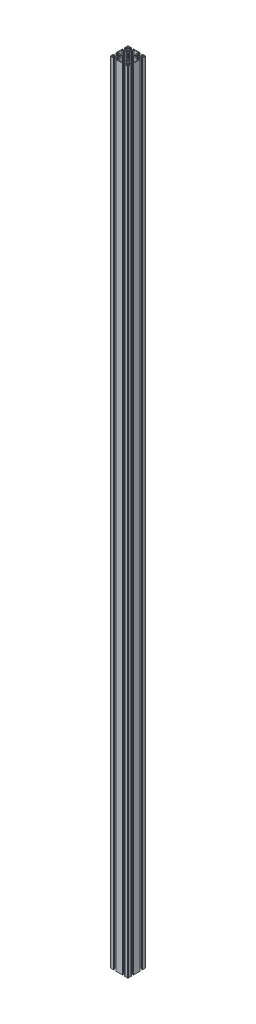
SolidWorks part; units mm, degrees
ref_plane "Front Plane" through (0, 0, 0) normal (0, 0, 1) x (1, 0, 0)
ref_plane "Top Plane" through (0, 0, 0) normal (0, 1, 0) x (1, 0, 0)
ref_plane "Right Plane" through (0, 0, 0) normal (1, 0, 0) x (0, 0, -1)
sketch "Sketch1" plane through (0, 0, 0) normal (0, 1, 0) x (1, 0, 0)
  line L0 (505.2058, 27.1189) -> (507.2058, 27.1189)
  line L1 (507.2058, 25.1189) -> (496.7058, 25.1189)
  line L2 (495.7058, 26.1189) -> (495.7058, 36.6189)
  line L3 (497.7058, 36.6189) -> (497.7058, 34.6189)
  line L4 (498.7058, 33.6189) -> (503.8258, 33.6189)
  line L5 (504.2058, 33.2389) -> (504.2058, 28.1189)
  line L6 (522.0488, 41.8952) -> (520.4218, 42.9309)
  line L7 (518.8935, 41.4027) -> (519.9294, 39.776)
  line L8 (517.7043, 38.8542) -> (517.2863, 40.7371)
  line L9 (515.125, 40.7371) -> (514.7072, 38.8544)
  line L10 (512.482, 39.776) -> (513.5178, 41.4029)
  line L11 (511.9896, 42.9313) -> (510.3629, 41.8954)
  line L12 (509.4411, 44.1204) -> (511.324, 44.5385)
  line L13 (511.324, 46.6998) -> (509.4413, 47.1175)
  line L14 (510.3628, 49.3427) -> (511.9898, 48.3069)
  line L15 (513.5181, 49.8351) -> (512.4822, 51.4618)
  line L16 (514.7073, 52.3836) -> (515.1254, 50.5008)
  line L17 (517.2867, 50.5007) -> (517.7044, 52.3835)
  line L18 (519.9296, 51.4619) -> (518.8938, 49.8349)
  line L19 (520.422, 48.3066) -> (522.0487, 49.3425)
  line L20 (522.9705, 47.1174) -> (521.0877, 46.6994)
  line L21 (521.0876, 44.5381) -> (522.9703, 44.1203)
  line L22 (579.7058, 34.6189) -> (579.7058, 36.6189)
  line L23 (581.7058, 36.6189) -> (581.7058, 26.1189)
  line L24 (580.7058, 25.1189) -> (570.2058, 25.1189)
  line L25 (570.2058, 27.1189) -> (572.2058, 27.1189)
  line L26 (573.2058, 28.1189) -> (573.2058, 33.2389)
  line L27 (573.5858, 33.6189) -> (578.7058, 33.6189)
  line L28 (565.422, 48.3066) -> (567.0487, 49.3425)
  line L29 (567.9705, 47.1174) -> (566.0877, 46.6994)
  line L30 (566.0876, 44.5381) -> (567.9703, 44.1203)
  line L31 (567.0488, 41.8952) -> (565.4218, 42.9309)
  line L32 (563.8935, 41.4027) -> (564.9294, 39.776)
  line L33 (562.7043, 38.8542) -> (562.2863, 40.7371)
  line L34 (560.125, 40.7371) -> (559.7072, 38.8544)
  line L35 (557.482, 39.776) -> (558.5178, 41.4029)
  line L36 (556.9896, 42.9313) -> (555.3629, 41.8954)
  line L37 (554.4411, 44.1204) -> (556.324, 44.5385)
  line L38 (556.324, 46.6998) -> (554.4413, 47.1175)
  line L39 (555.3628, 49.3427) -> (556.9898, 48.3069)
  line L40 (558.5181, 49.8351) -> (557.4822, 51.4618)
  line L41 (559.7073, 52.3836) -> (560.1254, 50.5008)
  line L42 (562.2867, 50.5007) -> (562.7044, 52.3835)
  line L43 (564.9296, 51.4619) -> (563.8938, 49.8349)
  line L44 (573.2058, 102.9989) -> (573.2058, 108.1189)
  line L45 (572.2058, 109.1189) -> (570.2058, 109.1189)
  line L46 (570.2058, 111.1189) -> (580.7058, 111.1189)
  line L47 (581.7058, 110.1189) -> (581.7058, 99.6189)
  line L48 (579.7058, 99.6189) -> (579.7058, 101.6189)
  line L49 (578.7058, 102.6189) -> (573.5858, 102.6189)
  line L50 (565.422, 93.3066) -> (567.0487, 94.3425)
  line L51 (567.9705, 92.1174) -> (566.0877, 91.6994)
  line L52 (566.0876, 89.5381) -> (567.9703, 89.1203)
  line L53 (567.0488, 86.8952) -> (565.4218, 87.9309)
  line L54 (563.8935, 86.4027) -> (564.9294, 84.776)
  line L55 (562.7043, 83.8542) -> (562.2863, 85.7371)
  line L56 (560.125, 85.7371) -> (559.7072, 83.8544)
  line L57 (557.482, 84.776) -> (558.5178, 86.4029)
  line L58 (556.9896, 87.9313) -> (555.3629, 86.8954)
  line L59 (554.4411, 89.1204) -> (556.324, 89.5385)
  line L60 (556.324, 91.6998) -> (554.4413, 92.1175)
  line L61 (555.3628, 94.3427) -> (556.9898, 93.3069)
  line L62 (558.5181, 94.8351) -> (557.4822, 96.4618)
  line L63 (559.7073, 97.3836) -> (560.1254, 95.5008)
  line L64 (562.2867, 95.5007) -> (562.7044, 97.3835)
  line L65 (564.9296, 96.4619) -> (563.8938, 94.8349)
  line L66 (497.7058, 101.6189) -> (497.7058, 99.6189)
  line L67 (495.7058, 99.6189) -> (495.7058, 110.1189)
  line L68 (496.7058, 111.1189) -> (507.2058, 111.1189)
  line L69 (507.2058, 109.1189) -> (505.2058, 109.1189)
  line L70 (504.2058, 108.1189) -> (504.2058, 102.9989)
  line L71 (503.8258, 102.6189) -> (498.7058, 102.6189)
  line L72 (522.0488, 86.8952) -> (520.4218, 87.9309)
  line L73 (518.8935, 86.4027) -> (519.9294, 84.776)
  line L74 (517.7043, 83.8542) -> (517.2863, 85.7371)
  line L75 (515.125, 85.7371) -> (514.7072, 83.8544)
  line L76 (512.482, 84.776) -> (513.5178, 86.4029)
  line L77 (511.9896, 87.9313) -> (510.3629, 86.8954)
  line L78 (509.4411, 89.1204) -> (511.324, 89.5385)
  line L79 (511.324, 91.6998) -> (509.4413, 92.1175)
  line L80 (510.3628, 94.3427) -> (511.9898, 93.3069)
  line L81 (513.5181, 94.8351) -> (512.4822, 96.4618)
  line L82 (514.7073, 97.3836) -> (515.1254, 95.5008)
  line L83 (517.2867, 95.5007) -> (517.7044, 97.3835)
  line L84 (519.9296, 96.4619) -> (518.8938, 94.8349)
  line L85 (520.422, 93.3066) -> (522.0487, 94.3425)
  line L86 (522.9705, 92.1174) -> (521.0877, 91.6994)
  line L87 (521.0876, 89.5381) -> (522.9703, 89.1203)
  line L88 (577.7058, 57.9589) -> (572.0832, 57.9589)
  line L89 (570.669, 57.3731) -> (568.5261, 55.2302)
  line L90 (568.2574, 55.1189) -> (562.1058, 55.1189)
  line L91 (562.1058, 55.1189) -> (561.2058, 54.6038)
  line L92 (561.2058, 54.6038) -> (560.3058, 55.1189)
  line L93 (560.3058, 55.1189) -> (553.7058, 55.1189)
  line L94 (551.7058, 53.1189) -> (551.7058, 46.5189)
  line L95 (551.7058, 46.5189) -> (552.2254, 45.6189)
  line L96 (552.2254, 45.6189) -> (551.7058, 44.7189)
  line L97 (551.7058, 44.7189) -> (551.7058, 38.5674)
  line L98 (551.5945, 38.2987) -> (550.0845, 36.7886)
  line L99 (549.2058, 34.6673) -> (549.2058, 28.1189)
  line L100 (550.2058, 27.1189) -> (552.2058, 27.1189)
  line L101 (552.2058, 25.1189) -> (525.2058, 25.1189)
  line L102 (525.2058, 27.1189) -> (527.2058, 27.1189)
  line L103 (528.2058, 28.1189) -> (528.2058, 34.6673)
  line L104 (527.3271, 36.7886) -> (525.8171, 38.2987)
  line L105 (525.7058, 38.5674) -> (525.7058, 44.7189)
  line L106 (525.7058, 44.7189) -> (525.1862, 45.6189)
  line L107 (525.1862, 45.6189) -> (525.7058, 46.5189)
  line L108 (525.7058, 46.5189) -> (525.7058, 53.1189)
  line L109 (523.7058, 55.1189) -> (517.1058, 55.1189)
  line L110 (517.1058, 55.1189) -> (516.2058, 54.6038)
  line L111 (516.2058, 54.6038) -> (515.3058, 55.1189)
  line L112 (515.3058, 55.1189) -> (509.1542, 55.1189)
  line L113 (508.8855, 55.2302) -> (506.7426, 57.3731)
  line L114 (505.3284, 57.9589) -> (499.7058, 57.9589)
  line L115 (497.7058, 55.9589) -> (497.7058, 54.6189)
  line L116 (495.7058, 54.6189) -> (495.7058, 81.6189)
  line L117 (497.7058, 81.6189) -> (497.7058, 80.2789)
  line L118 (499.7058, 78.2789) -> (505.3284, 78.2789)
  line L119 (506.7426, 78.8647) -> (508.8855, 81.0076)
  line L120 (509.1542, 81.1189) -> (515.3058, 81.1189)
  line L121 (515.3058, 81.1189) -> (516.2058, 81.6341)
  line L122 (516.2058, 81.6341) -> (517.1058, 81.1189)
  line L123 (517.1058, 81.1189) -> (523.7058, 81.1189)
  line L124 (525.7058, 83.1189) -> (525.7058, 89.7189)
  line L125 (525.7058, 89.7189) -> (525.1862, 90.6189)
  line L126 (525.1862, 90.6189) -> (525.7058, 91.5189)
  line L127 (525.7058, 91.5189) -> (525.7058, 97.6705)
  line L128 (525.8171, 97.9392) -> (527.3271, 99.4492)
  line L129 (528.2058, 101.5705) -> (528.2058, 108.1189)
  line L130 (527.2058, 109.1189) -> (525.2058, 109.1189)
  line L131 (525.2058, 111.1189) -> (552.2058, 111.1189)
  line L132 (552.2058, 109.1189) -> (550.2058, 109.1189)
  line L133 (549.2058, 108.1189) -> (549.2058, 101.5705)
  line L134 (550.0845, 99.4492) -> (551.5945, 97.9392)
  line L135 (551.7058, 97.6705) -> (551.7058, 91.5189)
  line L136 (551.7058, 91.5189) -> (552.2254, 90.6189)
  line L137 (552.2254, 90.6189) -> (551.7058, 89.7189)
  line L138 (551.7058, 89.7189) -> (551.7058, 83.1189)
  line L139 (553.7058, 81.1189) -> (560.3058, 81.1189)
  line L140 (560.3058, 81.1189) -> (561.2058, 81.6341)
  line L141 (561.2058, 81.6341) -> (562.1058, 81.1189)
  line L142 (562.1058, 81.1189) -> (568.2574, 81.1189)
  line L143 (568.5261, 81.0076) -> (570.6639, 78.8698)
  line L144 (572.0781, 78.284) -> (577.7058, 78.284)
  line L145 (579.7058, 80.284) -> (579.7058, 81.6189)
  line L146 (581.7058, 81.6189) -> (581.7058, 54.6189)
  line L147 (579.7058, 54.6189) -> (579.7058, 55.9589)
  line L148 (583.7058, 52.2039) -> (583.7058, 84.0339)
  line L149 (582.1858, 85.5539) -> (579.2258, 85.5539)
  line L150 (577.7058, 84.0339) -> (577.7058, 81.5689)
  line L151 (576.7058, 80.5689) -> (573.7042, 80.5689)
  line L152 (573.4355, 80.6802) -> (570.8171, 83.2987)
  line L153 (570.7058, 83.5674) -> (570.7058, 89.7189)
  line L154 (570.7058, 89.7189) -> (570.1862, 90.6189)
  line L155 (570.1862, 90.6189) -> (570.7058, 91.5189)
  line L156 (570.7058, 91.5189) -> (570.7058, 97.6705)
  line L157 (570.8171, 97.9392) -> (573.4355, 100.5576)
  line L158 (573.7042, 100.6689) -> (576.7058, 100.6689)
  line L159 (577.7058, 99.6689) -> (577.7058, 97.2039)
  line L160 (579.2258, 95.6839) -> (582.1858, 95.6839)
  line L161 (583.7058, 97.2039) -> (583.7058, 110.1189)
  line L162 (580.7058, 113.1189) -> (567.7908, 113.1189)
  line L163 (566.2708, 111.5989) -> (566.2708, 108.6389)
  line L164 (567.7908, 107.1189) -> (570.2558, 107.1189)
  line L165 (571.2558, 106.1189) -> (571.2558, 103.1174)
  line L166 (571.1445, 102.8487) -> (568.5261, 100.2302)
  line L167 (568.2574, 100.1189) -> (562.1058, 100.1189)
  line L168 (562.1058, 100.1189) -> (561.2058, 99.6038)
  line L169 (561.2058, 99.6038) -> (560.3058, 100.1189)
  line L170 (560.3058, 100.1189) -> (554.1542, 100.1189)
  line L171 (553.8855, 100.2302) -> (551.2671, 102.8487)
  line L172 (551.1558, 103.1174) -> (551.1558, 106.1189)
  line L173 (552.1558, 107.1189) -> (554.6208, 107.1189)
  line L174 (556.1408, 108.6389) -> (556.1408, 111.5989)
  line L175 (554.6208, 113.1189) -> (522.7908, 113.1189)
  line L176 (521.2708, 111.5989) -> (521.2708, 108.6389)
  line L177 (522.7908, 107.1189) -> (525.2558, 107.1189)
  line L178 (526.2558, 106.1189) -> (526.2558, 103.1174)
  line L179 (526.1445, 102.8487) -> (523.5261, 100.2302)
  line L180 (523.2574, 100.1189) -> (517.1058, 100.1189)
  line L181 (517.1058, 100.1189) -> (516.2058, 99.6038)
  line L182 (516.2058, 99.6038) -> (515.3058, 100.1189)
  line L183 (515.3058, 100.1189) -> (509.1542, 100.1189)
  line L184 (508.8855, 100.2302) -> (506.2671, 102.8487)
  line L185 (506.1558, 103.1174) -> (506.1558, 106.1189)
  line L186 (507.1558, 107.1189) -> (509.6208, 107.1189)
  line L187 (511.1408, 108.6389) -> (511.1408, 111.5989)
  line L188 (509.6208, 113.1189) -> (496.7058, 113.1189)
  line L189 (493.7058, 110.1189) -> (493.7058, 97.2039)
  line L190 (495.2258, 95.6839) -> (498.1858, 95.6839)
  line L191 (499.7058, 97.2039) -> (499.7058, 99.6689)
  line L192 (500.7058, 100.6689) -> (503.7074, 100.6689)
  line L193 (503.9761, 100.5576) -> (506.5945, 97.9392)
  line L194 (506.7058, 97.6705) -> (506.7058, 91.5189)
  line L195 (506.7058, 91.5189) -> (507.2254, 90.6189)
  line L196 (507.2254, 90.6189) -> (506.7058, 89.7189)
  line L197 (506.7058, 89.7189) -> (506.7058, 83.5674)
  line L198 (506.5945, 83.2987) -> (503.9761, 80.6802)
  line L199 (503.7074, 80.5689) -> (500.7058, 80.5689)
  line L200 (499.7058, 81.5689) -> (499.7058, 84.0339)
  line L201 (498.1858, 85.5539) -> (495.2258, 85.5539)
  line L202 (493.7058, 84.0339) -> (493.7058, 52.2039)
  line L203 (495.2258, 50.6839) -> (498.1858, 50.6839)
  line L204 (499.7058, 52.2039) -> (499.7058, 54.6689)
  line L205 (500.7058, 55.6689) -> (503.7074, 55.6689)
  line L206 (503.9761, 55.5576) -> (506.5945, 52.9392)
  line L207 (506.7058, 52.6705) -> (506.7058, 46.5189)
  line L208 (506.7058, 46.5189) -> (507.2254, 45.6189)
  line L209 (507.2254, 45.6189) -> (506.7058, 44.7189)
  line L210 (506.7058, 44.7189) -> (506.7058, 38.5674)
  line L211 (506.5945, 38.2987) -> (503.9761, 35.6802)
  line L212 (503.7074, 35.5689) -> (500.7058, 35.5689)
  line L213 (499.7058, 36.5689) -> (499.7058, 39.0339)
  line L214 (498.1858, 40.5539) -> (495.2258, 40.5539)
  line L215 (493.7058, 39.0339) -> (493.7058, 26.1189)
  line L216 (496.7058, 23.1189) -> (509.6208, 23.1189)
  line L217 (511.1408, 24.6389) -> (511.1408, 27.5989)
  line L218 (509.6208, 29.1189) -> (507.1558, 29.1189)
  line L219 (506.1558, 30.1189) -> (506.1558, 33.1205)
  line L220 (506.2671, 33.3892) -> (508.8855, 36.0076)
  line L221 (509.1542, 36.1189) -> (515.3058, 36.1189)
  line L222 (515.3058, 36.1189) -> (516.2058, 36.6341)
  line L223 (516.2058, 36.6341) -> (517.1058, 36.1189)
  line L224 (517.1058, 36.1189) -> (523.2574, 36.1189)
  line L225 (523.5261, 36.0076) -> (526.1445, 33.3892)
  line L226 (526.2558, 33.1205) -> (526.2558, 30.1189)
  line L227 (525.2558, 29.1189) -> (522.7908, 29.1189)
  line L228 (521.2708, 27.5989) -> (521.2708, 24.6389)
  line L229 (522.7908, 23.1189) -> (554.6208, 23.1189)
  line L230 (556.1408, 24.6389) -> (556.1408, 27.5989)
  line L231 (554.6208, 29.1189) -> (552.1558, 29.1189)
  line L232 (551.1558, 30.1189) -> (551.1558, 33.1205)
  line L233 (551.2671, 33.3892) -> (553.8855, 36.0076)
  line L234 (554.1542, 36.1189) -> (560.3058, 36.1189)
  line L235 (560.3058, 36.1189) -> (561.2058, 36.6341)
  line L236 (561.2058, 36.6341) -> (562.1058, 36.1189)
  line L237 (562.1058, 36.1189) -> (568.2574, 36.1189)
  line L238 (568.5261, 36.0076) -> (571.1445, 33.3892)
  line L239 (571.2558, 33.1205) -> (571.2558, 30.1189)
  line L240 (570.2558, 29.1189) -> (567.7908, 29.1189)
  line L241 (566.2708, 27.5989) -> (566.2708, 24.6389)
  line L242 (567.7908, 23.1189) -> (580.7058, 23.1189)
  line L243 (583.7058, 26.1189) -> (583.7058, 39.0339)
  line L244 (582.1858, 40.5539) -> (579.2258, 40.5539)
  line L245 (577.7058, 39.0339) -> (577.7058, 36.5689)
  line L246 (576.7058, 35.5689) -> (573.7042, 35.5689)
  line L247 (573.4355, 35.6802) -> (570.8171, 38.2987)
  line L248 (570.7058, 38.5674) -> (570.7058, 44.7189)
  line L249 (570.7058, 44.7189) -> (570.1862, 45.6189)
  line L250 (570.1862, 45.6189) -> (570.7058, 46.5189)
  line L251 (570.7058, 46.5189) -> (570.7058, 52.6705)
  line L252 (570.8171, 52.9392) -> (573.4355, 55.5576)
  line L253 (573.7042, 55.6689) -> (576.7058, 55.6689)
  line L254 (577.7058, 54.6689) -> (577.7058, 52.2039)
  line L255 (579.2258, 50.6839) -> (582.1858, 50.6839)
  arc A0 (504.2058, 28.1189) -> (505.2058, 27.1189) centre (505.2058, 28.1189) ccw
  arc A1 (507.2058, 25.1189) -> (507.2058, 27.1189) centre (507.2058, 26.1189) ccw
  arc A2 (495.7058, 26.1189) -> (496.7058, 25.1189) centre (496.7058, 26.1189) ccw
  arc A3 (497.7058, 36.6189) -> (495.7058, 36.6189) centre (496.7058, 36.6189) ccw
  arc A4 (497.7058, 34.6189) -> (498.7058, 33.6189) centre (498.7058, 34.6189) ccw
  arc A5 (504.2058, 33.2389) -> (503.8258, 33.6189) centre (503.8258, 33.2389) ccw
  arc A6 (523.4972, 42.3273) -> (523.6891, 42.7905) centre (516.2058, 45.6189) ccw
  arc A7 (522.0488, 41.8952) -> (523.4972, 42.3273) centre (522.5858, 42.7387) ccw
  arc A8 (518.8935, 41.4027) -> (520.4218, 42.9309) centre (516.2058, 45.6189) ccw
  arc A9 (519.4973, 38.3274) -> (519.9294, 39.776) centre (519.0859, 39.2389) ccw
  arc A10 (519.0341, 38.1355) -> (519.4973, 38.3274) centre (516.2058, 45.6189) ccw
  arc A11 (517.7043, 38.8542) -> (519.0341, 38.1355) centre (518.6805, 39.071) ccw
  arc A12 (515.125, 40.7371) -> (517.2863, 40.7371) centre (516.2058, 45.6189) ccw
  arc A13 (513.3774, 38.1356) -> (514.7072, 38.8544) centre (513.731, 39.071) ccw
  arc A14 (512.9142, 38.3275) -> (513.3774, 38.1356) centre (516.2058, 45.6189) ccw
  arc A15 (512.482, 39.776) -> (512.9142, 38.3275) centre (513.3256, 39.2389) ccw
  arc A16 (511.9896, 42.9313) -> (513.5178, 41.4029) centre (516.2058, 45.6189) ccw
  arc A17 (508.9143, 42.3274) -> (510.3629, 41.8954) centre (509.8258, 42.7388) ccw
  arc A18 (508.7224, 42.7907) -> (508.9143, 42.3274) centre (516.2058, 45.6189) ccw
  arc A19 (509.4411, 44.1204) -> (508.7224, 42.7907) centre (509.6579, 43.1442) ccw
  arc A20 (511.324, 46.6998) -> (511.324, 44.5385) centre (516.2058, 45.6189) ccw
  arc A21 (508.7225, 48.4473) -> (509.4413, 47.1175) centre (509.6579, 48.0938) ccw
  arc A22 (508.9144, 48.9106) -> (508.7225, 48.4473) centre (516.2058, 45.6189) ccw
  arc A23 (510.3628, 49.3427) -> (508.9144, 48.9106) centre (509.8258, 48.4991) ccw
  arc A24 (513.5181, 49.8351) -> (511.9898, 48.3069) centre (516.2058, 45.6189) ccw
  arc A25 (512.9143, 52.9104) -> (512.4822, 51.4618) centre (513.3257, 51.999) ccw
  arc A26 (513.3776, 53.1023) -> (512.9143, 52.9104) centre (516.2058, 45.6189) ccw
  arc A27 (514.7073, 52.3836) -> (513.3776, 53.1023) centre (513.7311, 52.1669) ccw
  arc A28 (517.2867, 50.5007) -> (515.1254, 50.5008) centre (516.2058, 45.6189) ccw
  arc A29 (519.0342, 53.1022) -> (517.7044, 52.3835) centre (518.6807, 52.1668) ccw
  arc A30 (519.4975, 52.9104) -> (519.0342, 53.1022) centre (516.2058, 45.6189) ccw
  arc A31 (519.9296, 51.4619) -> (519.4975, 52.9104) centre (519.086, 51.9989) ccw
  arc A32 (520.422, 48.3066) -> (518.8938, 49.8349) centre (516.2058, 45.6189) ccw
  arc A33 (523.4973, 48.9104) -> (522.0487, 49.3425) centre (522.5859, 48.499) ccw
  arc A34 (523.6892, 48.4472) -> (523.4973, 48.9104) centre (516.2058, 45.6189) ccw
  arc A35 (522.9705, 47.1174) -> (523.6892, 48.4472) centre (522.7538, 48.0937) ccw
  arc A36 (521.0876, 44.5381) -> (521.0877, 46.6994) centre (516.2058, 45.6189) ccw
  arc A37 (523.6891, 42.7905) -> (522.9703, 44.1203) centre (522.7537, 43.1441) ccw
  arc A38 (578.7058, 33.6189) -> (579.7058, 34.6189) centre (578.7058, 34.6189) ccw
  arc A39 (581.7058, 36.6189) -> (579.7058, 36.6189) centre (580.7058, 36.6189) ccw
  arc A40 (580.7058, 25.1189) -> (581.7058, 26.1189) centre (580.7058, 26.1189) ccw
  arc A41 (570.2058, 27.1189) -> (570.2058, 25.1189) centre (570.2058, 26.1189) ccw
  arc A42 (572.2058, 27.1189) -> (573.2058, 28.1189) centre (572.2058, 28.1189) ccw
  arc A43 (573.5858, 33.6189) -> (573.2058, 33.2389) centre (573.5858, 33.2389) ccw
  arc A44 (565.422, 48.3066) -> (563.8938, 49.8349) centre (561.2058, 45.6189) ccw
  arc A45 (568.4973, 48.9104) -> (567.0487, 49.3425) centre (567.5859, 48.499) ccw
  arc A46 (568.6892, 48.4472) -> (568.4973, 48.9104) centre (561.2058, 45.6189) ccw
  arc A47 (567.9705, 47.1174) -> (568.6892, 48.4472) centre (567.7538, 48.0937) ccw
  arc A48 (566.0876, 44.5381) -> (566.0877, 46.6994) centre (561.2058, 45.6189) ccw
  arc A49 (568.6891, 42.7905) -> (567.9703, 44.1203) centre (567.7537, 43.1441) ccw
  arc A50 (568.4972, 42.3273) -> (568.6891, 42.7905) centre (561.2058, 45.6189) ccw
  arc A51 (567.0488, 41.8952) -> (568.4972, 42.3273) centre (567.5858, 42.7387) ccw
  arc A52 (563.8935, 41.4027) -> (565.4218, 42.9309) centre (561.2058, 45.6189) ccw
  arc A53 (564.4973, 38.3274) -> (564.9294, 39.776) centre (564.0859, 39.2389) ccw
  arc A54 (564.0341, 38.1355) -> (564.4973, 38.3274) centre (561.2058, 45.6189) ccw
  arc A55 (562.7043, 38.8542) -> (564.0341, 38.1355) centre (563.6805, 39.071) ccw
  arc A56 (560.125, 40.7371) -> (562.2863, 40.7371) centre (561.2058, 45.6189) ccw
  arc A57 (558.3774, 38.1356) -> (559.7072, 38.8544) centre (558.731, 39.071) ccw
  arc A58 (557.9142, 38.3275) -> (558.3774, 38.1356) centre (561.2058, 45.6189) ccw
  arc A59 (557.482, 39.776) -> (557.9142, 38.3275) centre (558.3256, 39.2389) ccw
  arc A60 (556.9896, 42.9313) -> (558.5178, 41.4029) centre (561.2058, 45.6189) ccw
  arc A61 (553.9143, 42.3274) -> (555.3629, 41.8954) centre (554.8258, 42.7388) ccw
  arc A62 (553.7224, 42.7907) -> (553.9143, 42.3274) centre (561.2058, 45.6189) ccw
  arc A63 (554.4411, 44.1204) -> (553.7224, 42.7907) centre (554.6579, 43.1442) ccw
  arc A64 (556.324, 46.6998) -> (556.324, 44.5385) centre (561.2058, 45.6189) ccw
  arc A65 (553.7225, 48.4473) -> (554.4413, 47.1175) centre (554.6579, 48.0938) ccw
  arc A66 (553.9144, 48.9106) -> (553.7225, 48.4473) centre (561.2058, 45.6189) ccw
  arc A67 (555.3628, 49.3427) -> (553.9144, 48.9106) centre (554.8258, 48.4991) ccw
  arc A68 (558.5181, 49.8351) -> (556.9898, 48.3069) centre (561.2058, 45.6189) ccw
  arc A69 (557.9143, 52.9104) -> (557.4822, 51.4618) centre (558.3257, 51.999) ccw
  arc A70 (558.3776, 53.1023) -> (557.9143, 52.9104) centre (561.2058, 45.6189) ccw
  arc A71 (559.7073, 52.3836) -> (558.3776, 53.1023) centre (558.7311, 52.1669) ccw
  arc A72 (562.2867, 50.5007) -> (560.1254, 50.5008) centre (561.2058, 45.6189) ccw
  arc A73 (564.0342, 53.1022) -> (562.7044, 52.3835) centre (563.6807, 52.1668) ccw
  arc A74 (564.4975, 52.9104) -> (564.0342, 53.1022) centre (561.2058, 45.6189) ccw
  arc A75 (564.9296, 51.4619) -> (564.4975, 52.9104) centre (564.086, 51.9989) ccw
  arc A76 (573.2058, 102.9989) -> (573.5858, 102.6189) centre (573.5858, 102.9989) ccw
  arc A77 (573.2058, 108.1189) -> (572.2058, 109.1189) centre (572.2058, 108.1189) ccw
  arc A78 (570.2058, 111.1189) -> (570.2058, 109.1189) centre (570.2058, 110.1189) ccw
  arc A79 (581.7058, 110.1189) -> (580.7058, 111.1189) centre (580.7058, 110.1189) ccw
  arc A80 (579.7058, 99.6189) -> (581.7058, 99.6189) centre (580.7058, 99.6189) ccw
  arc A81 (579.7058, 101.6189) -> (578.7058, 102.6189) centre (578.7058, 101.6189) ccw
  arc A82 (565.422, 93.3066) -> (563.8938, 94.8349) centre (561.2058, 90.6189) ccw
  arc A83 (568.4973, 93.9104) -> (567.0487, 94.3425) centre (567.5859, 93.499) ccw
  arc A84 (568.6892, 93.4472) -> (568.4973, 93.9104) centre (561.2058, 90.6189) ccw
  arc A85 (567.9705, 92.1174) -> (568.6892, 93.4472) centre (567.7538, 93.0937) ccw
  arc A86 (566.0876, 89.5381) -> (566.0877, 91.6994) centre (561.2058, 90.6189) ccw
  arc A87 (568.6891, 87.7905) -> (567.9703, 89.1203) centre (567.7537, 88.1441) ccw
  arc A88 (568.4972, 87.3273) -> (568.6891, 87.7905) centre (561.2058, 90.6189) ccw
  arc A89 (567.0488, 86.8952) -> (568.4972, 87.3273) centre (567.5858, 87.7387) ccw
  arc A90 (563.8935, 86.4027) -> (565.4218, 87.9309) centre (561.2058, 90.6189) ccw
  arc A91 (564.4973, 83.3274) -> (564.9294, 84.776) centre (564.0859, 84.2389) ccw
  arc A92 (564.0341, 83.1355) -> (564.4973, 83.3274) centre (561.2058, 90.6189) ccw
  arc A93 (562.7043, 83.8542) -> (564.0341, 83.1355) centre (563.6805, 84.071) ccw
  arc A94 (560.125, 85.7371) -> (562.2863, 85.7371) centre (561.2058, 90.6189) ccw
  arc A95 (558.3774, 83.1356) -> (559.7072, 83.8544) centre (558.731, 84.071) ccw
  arc A96 (557.9142, 83.3275) -> (558.3774, 83.1356) centre (561.2058, 90.6189) ccw
  arc A97 (557.482, 84.776) -> (557.9142, 83.3275) centre (558.3256, 84.2389) ccw
  arc A98 (556.9896, 87.9313) -> (558.5178, 86.4029) centre (561.2058, 90.6189) ccw
  arc A99 (553.9143, 87.3274) -> (555.3629, 86.8954) centre (554.8258, 87.7388) ccw
  arc A100 (553.7224, 87.7907) -> (553.9143, 87.3274) centre (561.2058, 90.6189) ccw
  arc A101 (554.4411, 89.1204) -> (553.7224, 87.7907) centre (554.6579, 88.1442) ccw
  arc A102 (556.324, 91.6998) -> (556.324, 89.5385) centre (561.2058, 90.6189) ccw
  arc A103 (553.7225, 93.4473) -> (554.4413, 92.1175) centre (554.6579, 93.0938) ccw
  arc A104 (553.9144, 93.9106) -> (553.7225, 93.4473) centre (561.2058, 90.6189) ccw
  arc A105 (555.3628, 94.3427) -> (553.9144, 93.9106) centre (554.8258, 93.4991) ccw
  arc A106 (558.5181, 94.8351) -> (556.9898, 93.3069) centre (561.2058, 90.6189) ccw
  arc A107 (557.9143, 97.9104) -> (557.4822, 96.4618) centre (558.3257, 96.999) ccw
  arc A108 (558.3776, 98.1023) -> (557.9143, 97.9104) centre (561.2058, 90.6189) ccw
  arc A109 (559.7073, 97.3836) -> (558.3776, 98.1023) centre (558.7311, 97.1669) ccw
  arc A110 (562.2867, 95.5007) -> (560.1254, 95.5008) centre (561.2058, 90.6189) ccw
  arc A111 (564.0342, 98.1022) -> (562.7044, 97.3835) centre (563.6807, 97.1668) ccw
  arc A112 (564.4975, 97.9104) -> (564.0342, 98.1022) centre (561.2058, 90.6189) ccw
  arc A113 (564.9296, 96.4619) -> (564.4975, 97.9104) centre (564.086, 96.9989) ccw
  arc A114 (498.7058, 102.6189) -> (497.7058, 101.6189) centre (498.7058, 101.6189) ccw
  arc A115 (495.7058, 99.6189) -> (497.7058, 99.6189) centre (496.7058, 99.6189) ccw
  arc A116 (496.7058, 111.1189) -> (495.7058, 110.1189) centre (496.7058, 110.1189) ccw
  arc A117 (507.2058, 109.1189) -> (507.2058, 111.1189) centre (507.2058, 110.1189) ccw
  arc A118 (505.2058, 109.1189) -> (504.2058, 108.1189) centre (505.2058, 108.1189) ccw
  arc A119 (503.8258, 102.6189) -> (504.2058, 102.9989) centre (503.8258, 102.9989) ccw
  arc A120 (523.4972, 87.3273) -> (523.6891, 87.7905) centre (516.2058, 90.6189) ccw
  arc A121 (522.0488, 86.8952) -> (523.4972, 87.3273) centre (522.5858, 87.7387) ccw
  arc A122 (518.8935, 86.4027) -> (520.4218, 87.9309) centre (516.2058, 90.6189) ccw
  arc A123 (519.4973, 83.3274) -> (519.9294, 84.776) centre (519.0859, 84.2389) ccw
  arc A124 (519.0341, 83.1355) -> (519.4973, 83.3274) centre (516.2058, 90.6189) ccw
  arc A125 (517.7043, 83.8542) -> (519.0341, 83.1355) centre (518.6805, 84.071) ccw
  arc A126 (515.125, 85.7371) -> (517.2863, 85.7371) centre (516.2058, 90.6189) ccw
  arc A127 (513.3774, 83.1356) -> (514.7072, 83.8544) centre (513.731, 84.071) ccw
  arc A128 (512.9142, 83.3275) -> (513.3774, 83.1356) centre (516.2058, 90.6189) ccw
  arc A129 (512.482, 84.776) -> (512.9142, 83.3275) centre (513.3256, 84.2389) ccw
  arc A130 (511.9896, 87.9313) -> (513.5178, 86.4029) centre (516.2058, 90.6189) ccw
  arc A131 (508.9143, 87.3274) -> (510.3629, 86.8954) centre (509.8258, 87.7388) ccw
  arc A132 (508.7224, 87.7907) -> (508.9143, 87.3274) centre (516.2058, 90.6189) ccw
  arc A133 (509.4411, 89.1204) -> (508.7224, 87.7907) centre (509.6579, 88.1442) ccw
  arc A134 (511.324, 91.6998) -> (511.324, 89.5385) centre (516.2058, 90.6189) ccw
  arc A135 (508.7225, 93.4473) -> (509.4413, 92.1175) centre (509.6579, 93.0938) ccw
  arc A136 (508.9144, 93.9106) -> (508.7225, 93.4473) centre (516.2058, 90.6189) ccw
  arc A137 (510.3628, 94.3427) -> (508.9144, 93.9106) centre (509.8258, 93.4991) ccw
  arc A138 (513.5181, 94.8351) -> (511.9898, 93.3069) centre (516.2058, 90.6189) ccw
  arc A139 (512.9143, 97.9104) -> (512.4822, 96.4618) centre (513.3257, 96.999) ccw
  arc A140 (513.3776, 98.1023) -> (512.9143, 97.9104) centre (516.2058, 90.6189) ccw
  arc A141 (514.7073, 97.3836) -> (513.3776, 98.1023) centre (513.7311, 97.1669) ccw
  arc A142 (517.2867, 95.5007) -> (515.1254, 95.5008) centre (516.2058, 90.6189) ccw
  arc A143 (519.0342, 98.1022) -> (517.7044, 97.3835) centre (518.6807, 97.1668) ccw
  arc A144 (519.4975, 97.9104) -> (519.0342, 98.1022) centre (516.2058, 90.6189) ccw
  arc A145 (519.9296, 96.4619) -> (519.4975, 97.9104) centre (519.086, 96.9989) ccw
  arc A146 (520.422, 93.3066) -> (518.8938, 94.8349) centre (516.2058, 90.6189) ccw
  arc A147 (523.4973, 93.9104) -> (522.0487, 94.3425) centre (522.5859, 93.499) ccw
  arc A148 (523.6892, 93.4472) -> (523.4973, 93.9104) centre (516.2058, 90.6189) ccw
  arc A149 (522.9705, 92.1174) -> (523.6892, 93.4472) centre (522.7538, 93.0937) ccw
  arc A150 (521.0876, 89.5381) -> (521.0877, 91.6994) centre (516.2058, 90.6189) ccw
  arc A151 (523.6891, 87.7905) -> (522.9703, 89.1203) centre (522.7537, 88.1441) ccw
  arc A152 (579.7058, 55.9589) -> (577.7058, 57.9589) centre (577.7058, 55.9589) ccw
  arc A153 (572.0832, 57.9589) -> (570.669, 57.3731) centre (572.0832, 55.9589) ccw
  arc A154 (568.2574, 55.1189) -> (568.5261, 55.2302) centre (568.2574, 55.4989) ccw
  arc A155 (553.7058, 55.1189) -> (551.7058, 53.1189) centre (553.7058, 53.1189) ccw
  arc A156 (551.5945, 38.2987) -> (551.7058, 38.5674) centre (551.3258, 38.5674) ccw
  arc A157 (550.0845, 36.7886) -> (549.2058, 34.6673) centre (552.2058, 34.6673) ccw
  arc A158 (549.2058, 28.1189) -> (550.2058, 27.1189) centre (550.2058, 28.1189) ccw
  arc A159 (552.2058, 25.1189) -> (552.2058, 27.1189) centre (552.2058, 26.1189) ccw
  arc A160 (525.2058, 27.1189) -> (525.2058, 25.1189) centre (525.2058, 26.1189) ccw
  arc A161 (527.2058, 27.1189) -> (528.2058, 28.1189) centre (527.2058, 28.1189) ccw
  arc A162 (528.2058, 34.6673) -> (527.3271, 36.7886) centre (525.2058, 34.6673) ccw
  arc A163 (525.7058, 38.5674) -> (525.8171, 38.2987) centre (526.0858, 38.5674) ccw
  arc A164 (525.7058, 53.1189) -> (523.7058, 55.1189) centre (523.7058, 53.1189) ccw
  arc A165 (508.8855, 55.2302) -> (509.1542, 55.1189) centre (509.1542, 55.4989) ccw
  arc A166 (506.7426, 57.3731) -> (505.3284, 57.9589) centre (505.3284, 55.9589) ccw
  arc A167 (499.7058, 57.9589) -> (497.7058, 55.9589) centre (499.7058, 55.9589) ccw
  arc A168 (495.7058, 54.6189) -> (497.7058, 54.6189) centre (496.7058, 54.6189) ccw
  arc A169 (497.7058, 81.6189) -> (495.7058, 81.6189) centre (496.7058, 81.6189) ccw
  arc A170 (497.7058, 80.2789) -> (499.7058, 78.2789) centre (499.7058, 80.2789) ccw
  arc A171 (505.3284, 78.2789) -> (506.7426, 78.8647) centre (505.3284, 80.2789) ccw
  arc A172 (509.1542, 81.1189) -> (508.8855, 81.0076) centre (509.1542, 80.7389) ccw
  arc A173 (523.7058, 81.1189) -> (525.7058, 83.1189) centre (523.7058, 83.1189) ccw
  arc A174 (525.8171, 97.9392) -> (525.7058, 97.6705) centre (526.0858, 97.6705) ccw
  arc A175 (527.3271, 99.4492) -> (528.2058, 101.5705) centre (525.2058, 101.5705) ccw
  arc A176 (528.2058, 108.1189) -> (527.2058, 109.1189) centre (527.2058, 108.1189) ccw
  arc A177 (525.2058, 111.1189) -> (525.2058, 109.1189) centre (525.2058, 110.1189) ccw
  arc A178 (552.2058, 109.1189) -> (552.2058, 111.1189) centre (552.2058, 110.1189) ccw
  arc A179 (550.2058, 109.1189) -> (549.2058, 108.1189) centre (550.2058, 108.1189) ccw
  arc A180 (549.2058, 101.5705) -> (550.0845, 99.4492) centre (552.2058, 101.5705) ccw
  arc A181 (551.7058, 97.6705) -> (551.5945, 97.9392) centre (551.3258, 97.6705) ccw
  arc A182 (551.7058, 83.1189) -> (553.7058, 81.1189) centre (553.7058, 83.1189) ccw
  arc A183 (568.5261, 81.0076) -> (568.2574, 81.1189) centre (568.2574, 80.7389) ccw
  arc A184 (570.6639, 78.8698) -> (572.0781, 78.284) centre (572.0781, 80.284) ccw
  arc A185 (577.7058, 78.284) -> (579.7058, 80.284) centre (577.7058, 80.284) ccw
  arc A186 (581.7058, 81.6189) -> (579.7058, 81.6189) centre (580.7058, 81.6189) ccw
  arc A187 (579.7058, 54.6189) -> (581.7058, 54.6189) centre (580.7058, 54.6189) ccw
  arc A188 (583.7058, 84.0339) -> (582.1858, 85.5539) centre (582.1858, 84.0339) ccw
  arc A189 (579.2258, 85.5539) -> (577.7058, 84.0339) centre (579.2258, 84.0339) ccw
  arc A190 (576.7058, 80.5689) -> (577.7058, 81.5689) centre (576.7058, 81.5689) ccw
  arc A191 (573.4355, 80.6802) -> (573.7042, 80.5689) centre (573.7042, 80.9489) ccw
  arc A192 (570.7058, 83.5674) -> (570.8171, 83.2987) centre (571.0858, 83.5674) ccw
  arc A193 (570.8171, 97.9392) -> (570.7058, 97.6705) centre (571.0858, 97.6705) ccw
  arc A194 (573.7042, 100.6689) -> (573.4355, 100.5576) centre (573.7042, 100.2889) ccw
  arc A195 (577.7058, 99.6689) -> (576.7058, 100.6689) centre (576.7058, 99.6689) ccw
  arc A196 (577.7058, 97.2039) -> (579.2258, 95.6839) centre (579.2258, 97.2039) ccw
  arc A197 (582.1858, 95.6839) -> (583.7058, 97.2039) centre (582.1858, 97.2039) ccw
  arc A198 (583.7058, 110.1189) -> (580.7058, 113.1189) centre (580.7058, 110.1189) ccw
  arc A199 (567.7908, 113.1189) -> (566.2708, 111.5989) centre (567.7908, 111.5989) ccw
  arc A200 (566.2708, 108.6389) -> (567.7908, 107.1189) centre (567.7908, 108.6389) ccw
  arc A201 (571.2558, 106.1189) -> (570.2558, 107.1189) centre (570.2558, 106.1189) ccw
  arc A202 (571.1445, 102.8487) -> (571.2558, 103.1174) centre (570.8758, 103.1174) ccw
  arc A203 (568.2574, 100.1189) -> (568.5261, 100.2302) centre (568.2574, 100.4989) ccw
  arc A204 (553.8855, 100.2302) -> (554.1542, 100.1189) centre (554.1542, 100.4989) ccw
  arc A205 (551.1558, 103.1174) -> (551.2671, 102.8487) centre (551.5358, 103.1174) ccw
  arc A206 (552.1558, 107.1189) -> (551.1558, 106.1189) centre (552.1558, 106.1189) ccw
  arc A207 (554.6208, 107.1189) -> (556.1408, 108.6389) centre (554.6208, 108.6389) ccw
  arc A208 (556.1408, 111.5989) -> (554.6208, 113.1189) centre (554.6208, 111.5989) ccw
  arc A209 (522.7908, 113.1189) -> (521.2708, 111.5989) centre (522.7908, 111.5989) ccw
  arc A210 (521.2708, 108.6389) -> (522.7908, 107.1189) centre (522.7908, 108.6389) ccw
  arc A211 (526.2558, 106.1189) -> (525.2558, 107.1189) centre (525.2558, 106.1189) ccw
  arc A212 (526.1445, 102.8487) -> (526.2558, 103.1174) centre (525.8758, 103.1174) ccw
  arc A213 (523.2574, 100.1189) -> (523.5261, 100.2302) centre (523.2574, 100.4989) ccw
  arc A214 (508.8855, 100.2302) -> (509.1542, 100.1189) centre (509.1542, 100.4989) ccw
  arc A215 (506.1558, 103.1174) -> (506.2671, 102.8487) centre (506.5358, 103.1174) ccw
  arc A216 (507.1558, 107.1189) -> (506.1558, 106.1189) centre (507.1558, 106.1189) ccw
  arc A217 (509.6208, 107.1189) -> (511.1408, 108.6389) centre (509.6208, 108.6389) ccw
  arc A218 (511.1408, 111.5989) -> (509.6208, 113.1189) centre (509.6208, 111.5989) ccw
  arc A219 (496.7058, 113.1189) -> (493.7058, 110.1189) centre (496.7058, 110.1189) ccw
  arc A220 (493.7058, 97.2039) -> (495.2258, 95.6839) centre (495.2258, 97.2039) ccw
  arc A221 (498.1858, 95.6839) -> (499.7058, 97.2039) centre (498.1858, 97.2039) ccw
  arc A222 (500.7058, 100.6689) -> (499.7058, 99.6689) centre (500.7058, 99.6689) ccw
  arc A223 (503.9761, 100.5576) -> (503.7074, 100.6689) centre (503.7074, 100.2889) ccw
  arc A224 (506.7058, 97.6705) -> (506.5945, 97.9392) centre (506.3258, 97.6705) ccw
  arc A225 (506.5945, 83.2987) -> (506.7058, 83.5674) centre (506.3258, 83.5674) ccw
  arc A226 (503.7074, 80.5689) -> (503.9761, 80.6802) centre (503.7074, 80.9489) ccw
  arc A227 (499.7058, 81.5689) -> (500.7058, 80.5689) centre (500.7058, 81.5689) ccw
  arc A228 (499.7058, 84.0339) -> (498.1858, 85.5539) centre (498.1858, 84.0339) ccw
  arc A229 (495.2258, 85.5539) -> (493.7058, 84.0339) centre (495.2258, 84.0339) ccw
  arc A230 (493.7058, 52.2039) -> (495.2258, 50.6839) centre (495.2258, 52.2039) ccw
  arc A231 (498.1858, 50.6839) -> (499.7058, 52.2039) centre (498.1858, 52.2039) ccw
  arc A232 (500.7058, 55.6689) -> (499.7058, 54.6689) centre (500.7058, 54.6689) ccw
  arc A233 (503.9761, 55.5576) -> (503.7074, 55.6689) centre (503.7074, 55.2889) ccw
  arc A234 (506.7058, 52.6705) -> (506.5945, 52.9392) centre (506.3258, 52.6705) ccw
  arc A235 (506.5945, 38.2987) -> (506.7058, 38.5674) centre (506.3258, 38.5674) ccw
  arc A236 (503.7074, 35.5689) -> (503.9761, 35.6802) centre (503.7074, 35.9489) ccw
  arc A237 (499.7058, 36.5689) -> (500.7058, 35.5689) centre (500.7058, 36.5689) ccw
  arc A238 (499.7058, 39.0339) -> (498.1858, 40.5539) centre (498.1858, 39.0339) ccw
  arc A239 (495.2258, 40.5539) -> (493.7058, 39.0339) centre (495.2258, 39.0339) ccw
  arc A240 (493.7058, 26.1189) -> (496.7058, 23.1189) centre (496.7058, 26.1189) ccw
  arc A241 (509.6208, 23.1189) -> (511.1408, 24.6389) centre (509.6208, 24.6389) ccw
  arc A242 (511.1408, 27.5989) -> (509.6208, 29.1189) centre (509.6208, 27.5989) ccw
  arc A243 (506.1558, 30.1189) -> (507.1558, 29.1189) centre (507.1558, 30.1189) ccw
  arc A244 (506.2671, 33.3892) -> (506.1558, 33.1205) centre (506.5358, 33.1205) ccw
  arc A245 (509.1542, 36.1189) -> (508.8855, 36.0076) centre (509.1542, 35.7389) ccw
  arc A246 (523.5261, 36.0076) -> (523.2574, 36.1189) centre (523.2574, 35.7389) ccw
  arc A247 (526.2558, 33.1205) -> (526.1445, 33.3892) centre (525.8758, 33.1205) ccw
  arc A248 (525.2558, 29.1189) -> (526.2558, 30.1189) centre (525.2558, 30.1189) ccw
  arc A249 (522.7908, 29.1189) -> (521.2708, 27.5989) centre (522.7908, 27.5989) ccw
  arc A250 (521.2708, 24.6389) -> (522.7908, 23.1189) centre (522.7908, 24.6389) ccw
  arc A251 (554.6208, 23.1189) -> (556.1408, 24.6389) centre (554.6208, 24.6389) ccw
  arc A252 (556.1408, 27.5989) -> (554.6208, 29.1189) centre (554.6208, 27.5989) ccw
  arc A253 (551.1558, 30.1189) -> (552.1558, 29.1189) centre (552.1558, 30.1189) ccw
  arc A254 (551.2671, 33.3892) -> (551.1558, 33.1205) centre (551.5358, 33.1205) ccw
  arc A255 (554.1542, 36.1189) -> (553.8855, 36.0076) centre (554.1542, 35.7389) ccw
  arc A256 (568.5261, 36.0076) -> (568.2574, 36.1189) centre (568.2574, 35.7389) ccw
  arc A257 (571.2558, 33.1205) -> (571.1445, 33.3892) centre (570.8758, 33.1205) ccw
  arc A258 (570.2558, 29.1189) -> (571.2558, 30.1189) centre (570.2558, 30.1189) ccw
  arc A259 (567.7908, 29.1189) -> (566.2708, 27.5989) centre (567.7908, 27.5989) ccw
  arc A260 (566.2708, 24.6389) -> (567.7908, 23.1189) centre (567.7908, 24.6389) ccw
  arc A261 (580.7058, 23.1189) -> (583.7058, 26.1189) centre (580.7058, 26.1189) ccw
  arc A262 (583.7058, 39.0339) -> (582.1858, 40.5539) centre (582.1858, 39.0339) ccw
  arc A263 (579.2258, 40.5539) -> (577.7058, 39.0339) centre (579.2258, 39.0339) ccw
  arc A264 (576.7058, 35.5689) -> (577.7058, 36.5689) centre (576.7058, 36.5689) ccw
  arc A265 (573.4355, 35.6802) -> (573.7042, 35.5689) centre (573.7042, 35.9489) ccw
  arc A266 (570.7058, 38.5674) -> (570.8171, 38.2987) centre (571.0858, 38.5674) ccw
  arc A267 (570.8171, 52.9392) -> (570.7058, 52.6705) centre (571.0858, 52.6705) ccw
  arc A268 (573.7042, 55.6689) -> (573.4355, 55.5576) centre (573.7042, 55.2889) ccw
  arc A269 (577.7058, 54.6689) -> (576.7058, 55.6689) centre (576.7058, 54.6689) ccw
  arc A270 (577.7058, 52.2039) -> (579.2258, 50.6839) centre (579.2258, 52.2039) ccw
  arc A271 (582.1858, 50.6839) -> (583.7058, 52.2039) centre (582.1858, 52.2039) ccw
extrude "Extrude1" add sketch "Sketch1" along normal blind 4000
